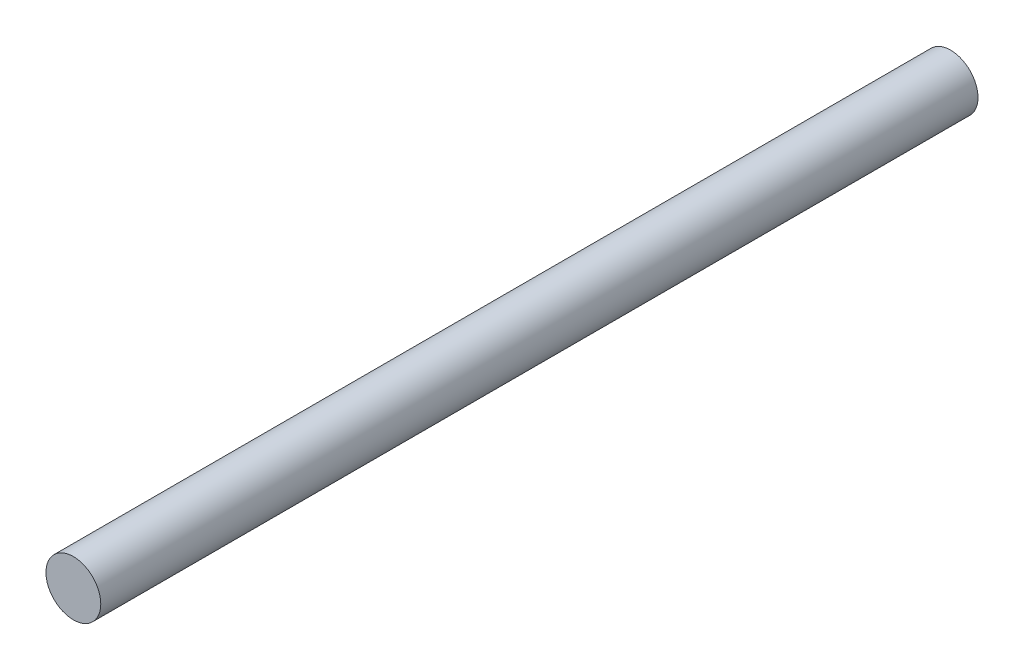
SolidWorks part; units mm, degrees
ref_plane "FRONT" through (0, 0, 0) normal (0, 0, 1) x (1, 0, 0)
ref_plane "TOP" through (0, 0, 0) normal (0, 1, 0) x (1, 0, 0)
ref_plane "RIGHT" through (0, 0, 0) normal (1, 0, 0) x (0, 0, -1)
sketch "Sketch1" plane through (0, 0, 0) normal (0, 0, 1) x (1, 0, 0)
  circle A0 centre (0, 0) radius 3.175
  dimension "D1" = 6.35
extrude "Base-Extrude" add sketch "Sketch1" along normal blind 101.6
